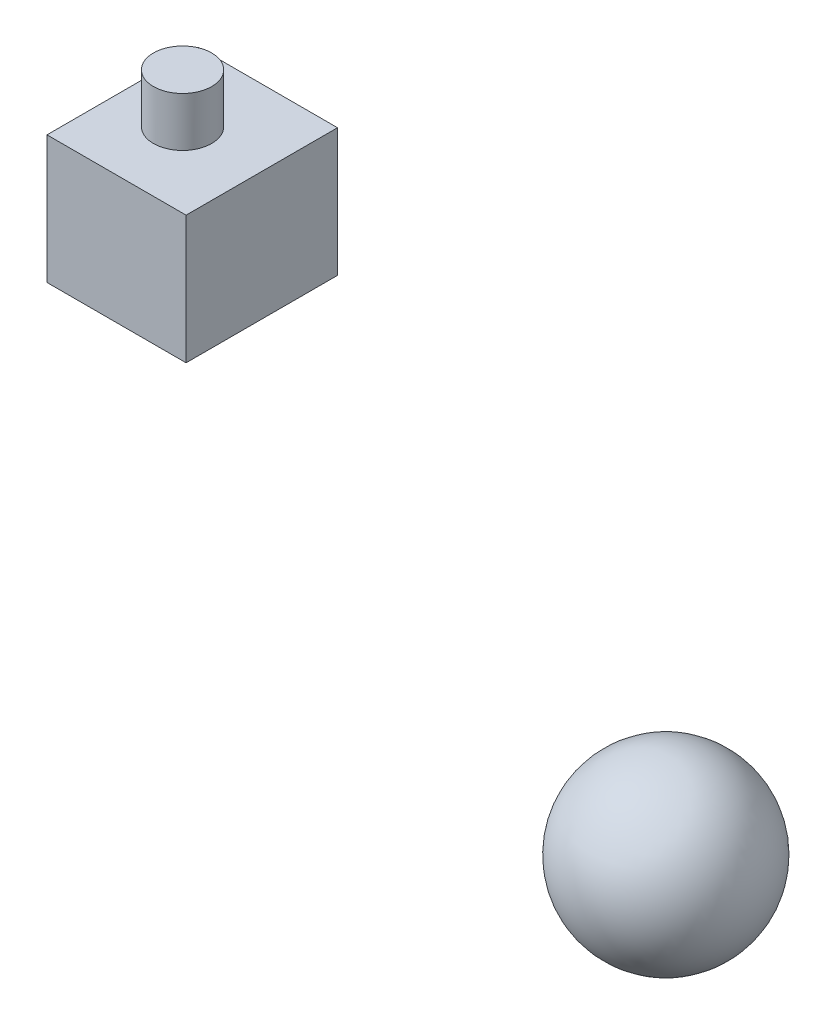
SolidWorks part; units mm, degrees
ref_plane "Front Plane" through (0, 0, 0) normal (0, 0, 1) x (1, 0, 0)
ref_plane "Top Plane" through (0, 0, 0) normal (0, 1, 0) x (1, 0, 0)
ref_plane "Right Plane" through (0, 0, 0) normal (1, 0, 0) x (0, 0, -1)
sketch "Sketch1"
revolve "Revolve1" add sketch "Sketch1" angle 360 about L0
sketch "Sketch2"
extrude "Extrude1" add sketch "Sketch2" along normal blind 78.74
sketch "Sketch3"
extrude "Extrude2" add sketch "Sketch3" along normal blind 25.654
